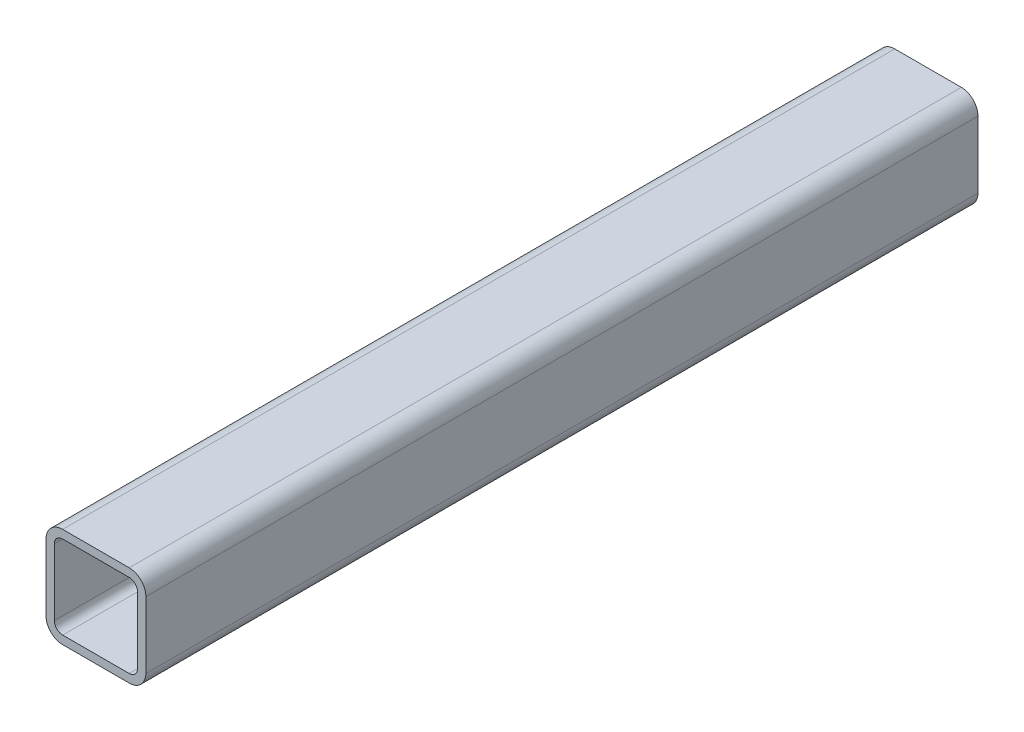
SolidWorks part; units mm, degrees
ref_plane "Front" through (0, 0, 0) normal (0, 0, 1) x (1, 0, 0)
ref_plane "Top" through (0, 0, 0) normal (0, 1, 0) x (1, 0, 0)
ref_plane "Right" through (0, 0, 0) normal (1, 0, 0) x (0, 0, -1)
sketch "Sketch1" plane through (0, 0, 0) normal (0, 0, 1) x (1, 0, 0)
  line L0 (-25.4, 38.1) -> (25.4, 38.1)
  line L1 (-38.1, 25.4) -> (-38.1, -25.4)
  line L2 (25.4, -38.1) -> (-25.4, -38.1)
  line L3 (38.1, -25.4) -> (38.1, 25.4)
  line L4 (0, -38.1) -> (0, 38.1) construction
  arc A0 (-38.1, 25.4) -> (-25.4, 38.1) centre (-25.4, 25.4) cw
  arc A1 (-25.4, -38.1) -> (-38.1, -25.4) centre (-25.4, -25.4) cw
  arc A2 (38.1, -25.4) -> (25.4, -38.1) centre (25.4, -25.4) cw
  arc A3 (38.1, 25.4) -> (25.4, 38.1) centre (25.4, 25.4) ccw
  dimension "D1" = 12.7
  dimension "D2" = 76.2
  dimension "D3" = 76.2
extrude "Base-Extrude-Thin" add sketch "Sketch1" along normal blind 635 thin
